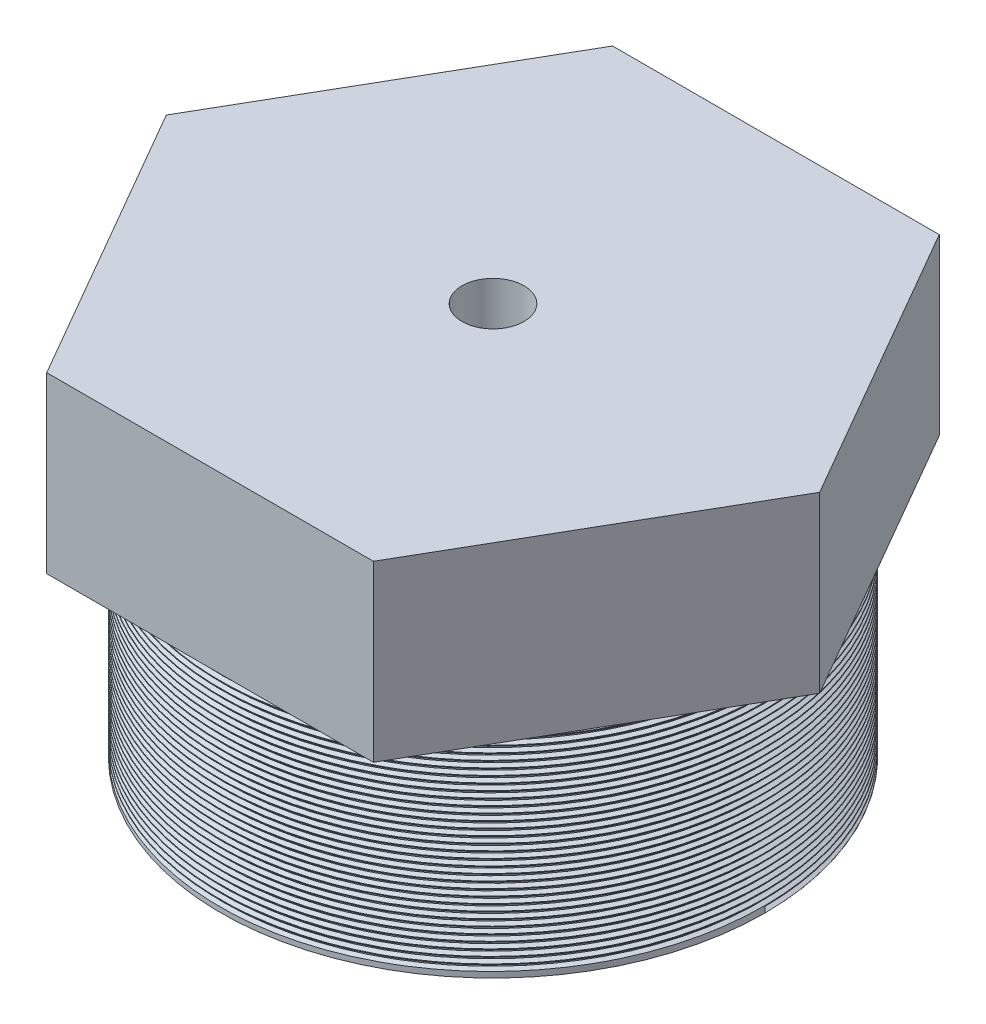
SolidWorks part; units mm, degrees
ref_plane "Front" through (0, 0, 0) normal (0, 0, 1) x (1, 0, 0)
ref_plane "Top" through (0, 0, 0) normal (0, 1, 0) x (1, 0, 0)
ref_plane "Right" through (0, 0, 0) normal (1, 0, 0) x (0, 0, -1)
sketch "Sketch1" plane through (0, 0, 0) normal (0, 1, 0) x (1, 0, 0)
  line L1 (15.0111, 0) -> (7.5056, 13)
  line L2 (7.5056, 13) -> (-7.5056, 13)
  line L3 (-7.5056, 13) -> (-15.0111, 0)
  line L4 (-15.0111, 0) -> (-7.5056, -13)
  line L5 (-7.5056, -13) -> (7.5056, -13)
  line L6 (7.5056, -13) -> (15.0111, 0)
  circle A0 centre (0, 0) radius 13 construction
  circle A1 centre (0, 0) radius 1.425
  dimension "D1" = 26
  dimension "D2" = 2.85
extrude "Boss-Extrude1" add sketch "Sketch1" along normal blind 8
sketch "Sketch2" plane through (0, 0, 0) normal (0, -1, 0) x (1, 0, 0)
  circle A0 centre (0, 0) radius 12.5
  dimension "D1" = 25
extrude "Extrude-Thin1" add sketch "Sketch2" along normal blind 10 thin
thread "Thread1" pitch 0.3 start angle 0, offset 0, length 10, pitch 0.3, diameter 25
ref_plane "Plane1" through (12.5, -10, 0) normal (0, 0, 1) x (1, 0, 0)
sketch "Thread Profile1" plane through (12.5, -10, 0) normal (0, 0, 1) x (1, 0, 0)
  line L0 (0, 0) -> (0, 0.3) construction
  line L11 (0, 0) -> (0, 0.2625)
  line L12 (0, 0.2625) -> (-0.1624, 0.1687)
  line L13 (-0.1624, 0.1687) -> (-0.1624, 0.0937)
  line L15 (-0.1624, 0.0937) -> (0, 0)
  line L17 (-0.1624, 0.1312) -> (0, 0.1312) construction
  point P2 (0, 0)
  dimension "Pitch" = 0.3
  dimension "Profile_Angle" = 60
  dimension "Profile_Land" = 0.075
  dimension "Profile_Height" = 0.1624
